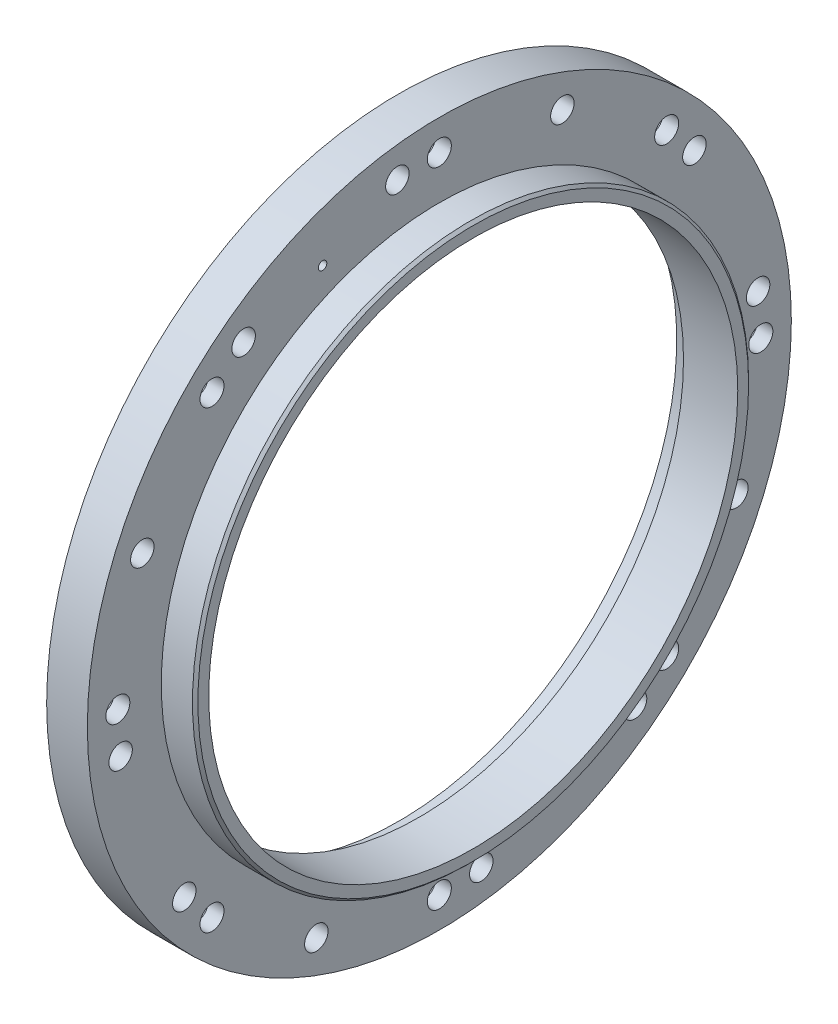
SolidWorks part; units mm, degrees
ref_plane "Front Plane" through (0, 0, 0) normal (0, 0, 1) x (1, 0, 0)
ref_plane "Top Plane" through (0, 0, 0) normal (0, 1, 0) x (1, 0, 0)
ref_plane "Right Plane" through (0, 0, 0) normal (1, 0, 0) x (0, 0, -1)
sketch "Sketch1" plane through (0, 0, 0) normal (1, 0, 0) x (0, 0, -1)
  circle A0 centre (0, 0) radius 65.913
  dimension "D1" = 131.826
extrude "Boss-Extrude1" add sketch "Sketch1" along normal blind 7.62
sketch "Sketch2" plane through (7.62, 0, 0) normal (1, 0, 0) x (0, 0, -1)
  circle A0 centre (0, 0) radius 49.53
  dimension "D1" = 99.06
extrude "Cut-Extrude1" cut sketch "Sketch2" against normal through all
hole_wizard "CBORE for #8 Socket Head Cap Screw1" positions "Sketch4" profile "Sketch5" counterbore size "#8" standard "ANSI Inch"
sketch "Sketch4" plane through (0, 0, 0) normal (-1, 0, 0) x (0, 0, 1)
  point P0 (0, 60.198)
  dimension "D1" = 60.198
sketch "Sketch5" plane through (0, 60.198, 0) normal (0, 1, 0) x (0, 0, 1)
  line L0 (0, 0) -> (0, 7.62)
  line L1 (0, 7.62) -> (2.2479, 7.62)
  line L3 (2.2479, 7.62) -> (2.2479, 4.6736)
  line L4 (3.9687, 4.6736) -> (2.2479, 4.6736)
  line L5 (3.9687, 4.6736) -> (3.9688, 0.2849)
  line L6 (3.9688, 0.2849) -> (4.2164, 0)
  line L7 (4.2164, 0) -> (0, 0)
  line L8 (-3.9688, 0.2849) -> (-4.2164, 0) construction
  line L11 (0, -6.35) -> (0, 107.95) construction
  dimension "Thru Hole Dia." = 4.4958
  dimension "Thru Hole Depth" = 7.62
  dimension "C'Bore Dia." = 7.9375
  dimension "C'Bore Depth" = 4.6736
  dimension "Near C'Sink Dia." = 8.4328
  dimension "Near C'Sink Angle" = 82
pattern_circular "CirPattern1" count 8 over 360 about axis through (0, 0, 0) along (1, 0, 0) of "CBORE for #8 Socket Head Cap Screw1"
hole_wizard "Tapped Hole for #8-32 Helicoil1" positions "Sketch9" profile "Sketch10" tap size "#8-32" standard "Helicoil® Inch"
sketch "Sketch9" plane through (0, 0, 0) normal (-1, 0, 0) x (0, 0, 1)
  line L0 (-23.0368, 55.6157) -> (0, 0)
  line L1 (0, 0) -> (0, 60.198)
  point P0 (-23.0368, 55.6157)
  dimension "D1" = 60.198
  dimension "D2" = 22.5
sketch "Sketch10" plane through (0, 55.6157, -23.0368) normal (0, 1, 0) x (0, 0, 1)
  line L0 (0, 0) -> (0, 16.8396)
  line L1 (0, 16.8396) -> (2.1971, 15.5194)
  line L2 (2.1971, 15.5194) -> (2.1971, 0)
  line L5 (2.1971, 0) -> (0, 0)
  line L10 (0, 16.8396) -> (-2.1971, 15.5194) construction
  line L11 (0, -6.35) -> (0, 107.95) construction
  dimension "Tap Drill Dia." = 4.3942
  dimension "Tap Drill Depth" = 15.5194
  dimension "Drill Angle" = 118
pattern_circular "CirPattern3" count 12 over 360 about axis through (0, 0, 0) along (1, 0, 0) of "Tapped Hole for #8-32 Helicoil1"
sketch "Sketch11" plane through (7.62, 0, 0) normal (1, 0, 0) x (0, 0, -1)
  circle A0 centre (0, 0) radius 52.07
extrude "Boss-Extrude2" add sketch "Sketch11" along normal blind 6.35
sketch "Sketch12" plane through (13.97, 0, 0) normal (1, 0, 0) x (0, 0, -1)
  circle A0 centre (0, 0) radius 49.53
  dimension "D1" = 99.06
extrude "Cut-Extrude2" cut sketch "Sketch12" against normal blind 12.7
chamfer "Chamfer1" distance 0.508 angle 45 1 edges at (13.97, 0, -52.07)
sketch "Sketch13" plane through (0, 0, 0) normal (-1, 0, 0) x (0, 0, 1)
  circle A0 centre (0, 0) radius 52.07
extrude "Cut-Extrude3" cut sketch "Sketch13" against normal blind 3.81
sketch "Sketch14" plane through (0, 0, 0) normal (-1, 0, 0) x (0, 0, 1)
  line L0 (7.8574, 59.683) -> (36.6462, 47.7583) construction
  line L3 (11.6424, 64.8766) -> (19.2281, 63.046) construction
  circle A0 centre (0, 0) radius 65.913 construction
sketch "Sketch15" plane through (0, 0, 0) normal (-1, 0, 0) x (0, 0, 1)
  line L0 (22.2518, 53.7206) -> (25.2238, 60.8957) construction
  line L1 (7.8574, 59.683) -> (36.6462, 47.7583) construction
  line L2 (25.2238, 60.8957) -> (19.9263, 48.1064) construction
  circle A0 centre (0, 0) radius 65.913 construction
  circle A1 centre (0, 0) radius 52.07 construction
hole_wizard "1/16 (0.0625) Clearance Dowel Hole1" positions "Sketch18" profile "Sketch19" hole size "1/16" standard "ANSI Inch"
sketch "Sketch18" plane through (0, 0, 0) normal (-1, 0, 0) x (0, 0, 1)
  point P0 (-21.8704, -52.7997)
sketch "Sketch19" plane through (0, -52.7997, -21.8704) normal (0, 1, 0) x (0, 0, 1)
  line L0 (0, 0) -> (0, 13.97)
  line L1 (0, 13.97) -> (0.7937, 13.97)
  line L2 (0.7937, 13.97) -> (0.7937, 0)
  line L5 (0.7937, 0) -> (0, 0)
  line L11 (0, -6.35) -> (0, 107.95) construction
  dimension "Thru Hole Dia." = 1.5875
  dimension "Thru Hole Depth" = 13.97
hole_wizard "1/16 (0.0625) Press Dowel Hole1" positions "Sketch20" profile "Sketch21" hole size "1/16" standard "ANSI Inch"
sketch "Sketch20" plane through (0, 0, 0) normal (-1, 0, 0) x (0, 0, 1)
  point P0 (21.8704, 52.7997)
sketch "Sketch21" plane through (0, 52.7997, 21.8704) normal (0, 1, 0) x (0, 0, 1)
  line L0 (0, 0) -> (0, 13.97)
  line L1 (0, 13.97) -> (0.7937, 13.97)
  line L2 (0.7937, 13.97) -> (0.7937, 0)
  line L5 (0.7937, 0) -> (0, 0)
  line L11 (0, -6.35) -> (0, 107.95) construction
  dimension "Thru Hole Dia." = 1.5875
  dimension "Thru Hole Depth" = 13.97
